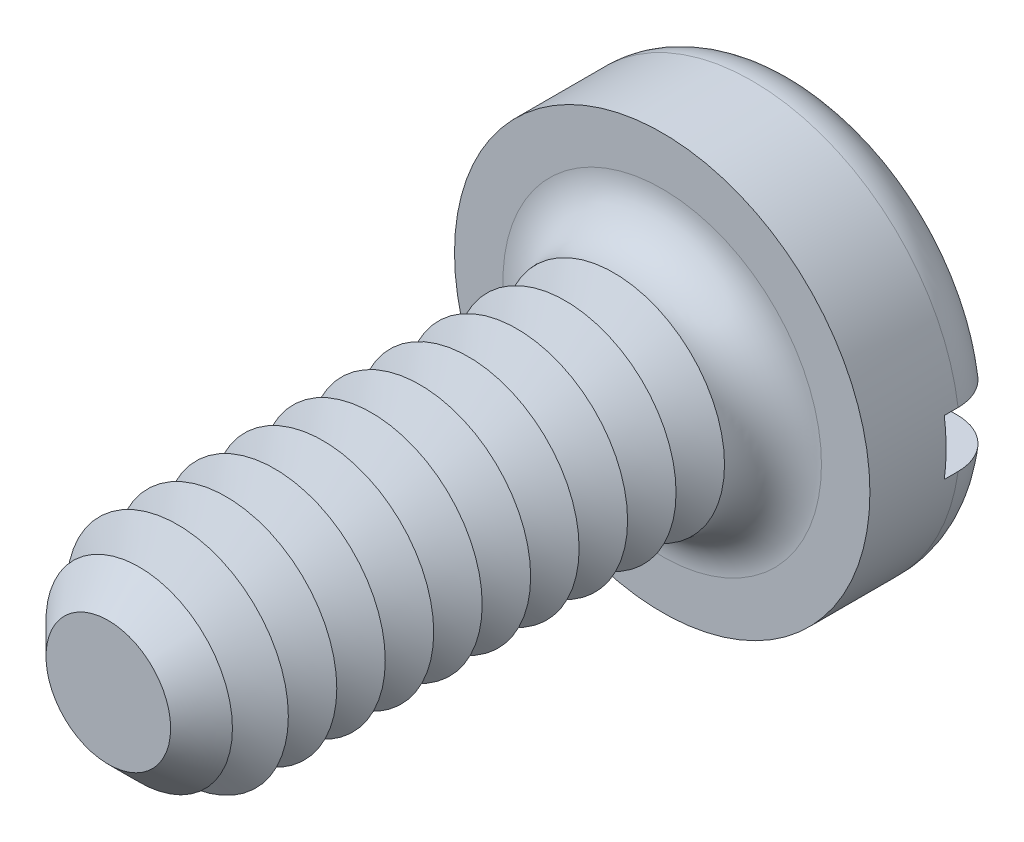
SolidWorks part; units mm, degrees
ref_plane "Front Plane" through (0, 0, 0) normal (0, 0, 1) x (1, 0, 0)
ref_plane "Top Plane" through (0, 0, 0) normal (0, 1, 0) x (1, 0, 0)
ref_plane "Right Plane" through (0, 0, 0) normal (1, 0, 0) x (0, 0, -1)
sketch "Sketch3" plane through (0, 0, 0) normal (0, 0, 1) x (1, 0, 0)
  circle A0 centre (0, 0) radius 1.5
  dimension "D1" = 3
extrude "Boss-Extrude2" add sketch "Sketch3" against normal blind 1
sketch "Sketch4" plane through (0, 0, 0) normal (0, 0, 1) x (1, 0, 0)
  circle A0 centre (0, 0) radius 0.8
  dimension "D1" = 1.6
extrude "Boss-Extrude3" add sketch "Sketch4" along normal blind 4
fillet "Fillet1" radius 0.35 2 edges at (1.5, 0, -1) (0.8, 0, 0)
chamfer "Chamfer1" distance 0.35 angle 45 1 edges at (0.8, 0, 4)
sketch "Sketch5" plane through (0, 0, 0) normal (1, 0, 0) x (0, 0, -1)
  line L0 (1.6944, 0) -> (-7.6738, 0) construction
sketch "Sketch6" plane through (0, 0, 0) normal (1, 0, 0) x (0, 0, -1)
  line L0 (-0.35, 0.8) -> (-0.525, 0.4969)
  line L1 (-0.525, 0.4969) -> (-0.7, 0.8)
  line L2 (-0.35, 0.8) -> (-3.65, 0.8) construction
  line L3 (-0.7, 0.8) -> (-0.35, 0.8)
  dimension "D1" = 0.35
revolve "Cut-Revolve1" cut sketch "Sketch6" angle 360 about L0
pattern_linear "LPattern1" count 10 spacing 0.35 along (0, 0, 1) of "Cut-Revolve1"
sketch "Sketch8" plane through (0, 0, -1) normal (0, 0, -1) x (-1, 0, 0)
  line L1 (1.5, -0.2) -> (-1.5, -0.2)
  line L2 (1.5, -0.2) -> (1.5, 0.2)
  line L3 (1.5, 0.2) -> (-1.5, 0.2)
  line L4 (-1.5, -0.2) -> (-1.5, 0.2)
  line L5 (1.5, -0.2) -> (-1.5, 0.2) construction
  line L6 (1.5, 0.2) -> (-1.5, -0.2) construction
  point P0 (0, 0)
  dimension "D1" = 3
  dimension "D2" = 0.4
extrude "Cut-Extrude1" cut sketch "Sketch8" against normal blind 0.45
